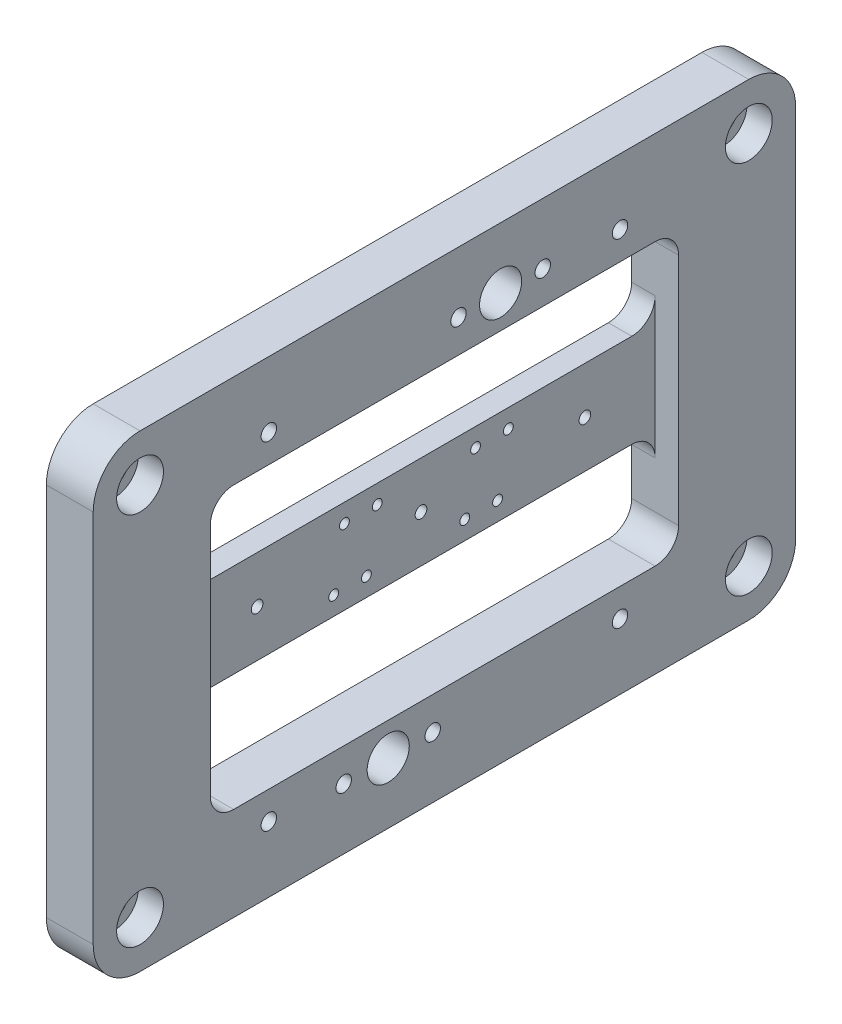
SolidWorks part; units mm, degrees
ref_plane "前视基准面" through (0, 0, 0) normal (0, 0, 1) x (1, 0, 0)
ref_plane "上视基准面" through (0, 0, 0) normal (0, 1, 0) x (1, 0, 0)
ref_plane "右视基准面" through (0, 0, 0) normal (1, 0, 0) x (0, 0, -1)
sketch "草图1" plane through (0, 0, 0) normal (1, 0, 0) x (0, 0, -1)
  line L1 (-65, 50) -> (65, 50)
  line L2 (-75, 40) -> (-75, -40)
  line L3 (-65, -50) -> (65, -50)
  line L4 (75, 40) -> (75, -40)
  line L5 (-75, 50) -> (75, -50) construction
  line L6 (-75, -50) -> (75, 50) construction
  arc A0 (65, 50) -> (75, 40) centre (65, 40) cw
  arc A1 (-75, -40) -> (-65, -50) centre (-65, -40) ccw
  arc A2 (-65, 50) -> (-75, 40) centre (-65, 40) ccw
  arc A3 (65, -50) -> (75, -40) centre (65, -40) ccw
  point P0 (0, 0)
  dimension "D3" = 10
  dimension "D1" = 150
  dimension "D2" = 100
extrude "凸台-拉伸1" add sketch "草图1" along normal blind 10
hole_wizard "Ø12.0mm 暗销孔1" positions "草图2" profile "草图3" hole size "Ø12.0" standard "ISO"
sketch "草图2" plane through (0, 0, 0) normal (-1, 0, 0) x (0, 0, 1)
  line L0 (0, 0) -> (12, 0) construction
  line L2 (0, 0) -> (0, 37) construction
  line L3 (-12, 37) -> (12, 37)
  line L4 (12, 37) -> (12, -37)
  point P0 (-12, 37)
  point P13 (12, -37)
  dimension "D1" = 74
  dimension "D2" = 24
sketch "草图3" plane through (0, 37, -12) normal (0, 1, 0) x (0, 0, 1)
  line L0 (0, 0) -> (0, 2.9)
  line L1 (0, 2.9) -> (6.1, 2.9)
  line L2 (6.1, 2.9) -> (6.1, 0)
  line L5 (6.1, 0) -> (0, 0)
  line L10 (0, 2.9) -> (-6.1, 2.9) construction
  line L11 (0, -6.35) -> (0, 107.95) construction
  dimension "孔直径" = 12.2
  dimension "孔深度" = 2.9
  dimension "导头角度" = 180
hole_wizard "Ø9.0 (9) 直径孔1" positions "草图4" profile "草图5" hole size "Ø9.0" standard "ISO"
sketch "草图4" plane through (10, 0, 0) normal (1, 0, 0) x (0, 0, -1)
  point P29 (-12, -37)
  point P35 (12, 37)
sketch "草图5" plane through (10, -37, 12) normal (0, 1, 0) x (0, 0, -1)
  line L0 (0, 0) -> (0, 17.7039)
  line L1 (0, 17.7039) -> (4.5, 15)
  line L2 (4.5, 15) -> (4.5, 0)
  line L5 (4.5, 0) -> (0, 0)
  line L10 (0, 17.7039) -> (-4.5, 15) construction
  line L11 (0, -6.35) -> (0, 107.95) construction
  dimension "孔直径" = 9
  dimension "孔深度" = 15
  dimension "导头角度" = 118
sketch "草图13" plane through (0, 0, 0) normal (-1, 0, 0) x (0, 0, 1)
  line L0 (0, 0) -> (93.0894, 0) construction
  line L1 (0, 0) -> (0, 31.3557) construction
  circle A2 centre (65, 40) radius 4
  circle A10 centre (65, -40) radius 4
  circle A11 centre (-65, -40) radius 4
  circle A12 centre (-65, 40) radius 4
  dimension "D1" = 8
  dimension "D2" = 65
  dimension "D3" = 40
extrude "切除-拉伸2" cut sketch "草图13" against normal blind 2.6
hole_wizard "M5 六角凹头螺钉的柱形沉头孔1" positions "草图14" profile "草图15" counterbore size "M5" standard "ISO"
sketch "草图14" plane through (10, 0, 0) normal (1, 0, 0) x (0, 0, -1)
  point P0 (-65, 40)
  point P3 (65, 40)
  point P6 (65, -40)
  point P9 (-65, -40)
sketch "草图15" plane through (10, 40, 65) normal (0, 1, 0) x (0, 0, -1)
  line L0 (0, 0) -> (0, 10)
  line L1 (0, 10) -> (2.75, 10)
  line L3 (2.75, 10) -> (2.75, 5.4)
  line L4 (2.75, 5.4) -> (5, 5.4)
  line L5 (5, 5.4) -> (5, 0)
  line L7 (5, 0) -> (0, 0)
  line L11 (0, -6.35) -> (0, 107.95) construction
  dimension "通孔孔直径" = 5.5
  dimension "通孔孔深度" = 10
  dimension "柱形沉头孔直径" = 10
  dimension "柱形沉头孔深度" = 5.4
hole_wizard "M4 螺纹孔1" positions "草图16" profile "草图17" tap size "M4" standard "ISO"
sketch "草图16" plane through (0, 0, 0) normal (-1, 0, 0) x (0, 0, 1)
  line L0 (-12, 37) -> (-3, 37) construction
  line L1 (-12, 37) -> (112.3189, 37) construction
  line L3 (-12, 37) -> (-12, 24.2303) construction
  line L4 (12, -37) -> (21.5, -37) construction
  line L5 (12, -37) -> (12, -21.6104) construction
  point P2 (-3, 37)
  point P15 (21.5, -37)
  point P21 (2.5, -37)
  point P22 (-21, 37)
  dimension "D1" = 9
  dimension "D2" = 9.5
sketch "草图17" plane through (0, 37, -21) normal (0, 1, 0) x (0, 0, 1)
  line L0 (0, 0) -> (0, 10)
  line L1 (0, 10) -> (1.65, 10)
  line L2 (1.65, 10) -> (1.65, 0)
  line L5 (1.65, 0) -> (0, 0)
  line L11 (0, -6.35) -> (0, 107.95) construction
  dimension "通孔螺纹孔钻头直径" = 3.3
  dimension "通孔螺纹孔钻头深度" = 10
sketch "草图18" plane through (0, 0, 0) normal (-1, 0, 0) x (0, 0, 1)
  line L1 (-50, 30) -> (50, 30)
  line L2 (-50, 30) -> (-50, -30)
  line L3 (-50, -30) -> (50, -30)
  line L4 (50, 30) -> (50, -30)
  line L5 (0, -30) -> (0, 30) construction
  line L6 (-50, 0) -> (50, 0) construction
  point P0 (0, 0)
  dimension "D1" = 60
  dimension "D2" = 100
extrude "切除-拉伸3" cut sketch "草图18" against normal through all
fillet "圆角1" radius 5 4 edges at (5, -30, -50) (5, 30, 50) (5, -30, 50) (5, 30, -50)
hole_wizard "M4 螺纹孔2" positions "草图26" profile "草图27" tap size "M4" standard "ISO"
sketch "草图26" plane through (0, 0, 0) normal (-1, 0, 0) x (0, 0, 1)
  line L2 (0, 0) -> (85.8672, 0) construction
  line L4 (0, 0) -> (0, -71.871) construction
  point P0 (37.5, -36)
  point P13 (37.5, 36)
  point P20 (-37.5, 36)
  point P21 (-37.5, -36)
  dimension "D1" = 72
  dimension "D2" = 75
sketch "草图27" plane through (0, -36, 37.5) normal (0, 1, 0) x (0, 0, 1)
  line L0 (0, 0) -> (0, 10)
  line L1 (0, 10) -> (1.65, 10)
  line L2 (1.65, 10) -> (1.65, 0)
  line L5 (1.65, 0) -> (0, 0)
  line L11 (0, -6.35) -> (0, 107.95) construction
  dimension "通孔螺纹孔钻头直径" = 3.3
  dimension "通孔螺纹孔钻头深度" = 10
hole_wizard "M3 螺纹孔3" positions "草图28" profile "草图29" tap size "M3" standard "ISO"
sketch "草图28" [suppressed] plane through (0, 0, 0) normal (-1, 0, 0) x (0, 0, 1)
  line L0 (-65, 27.5) -> (-65, 10.5403) construction
  line L2 (65, -27.5) -> (65, -10.747) construction
  circle A0 centre (-65, 27.5) radius 5 construction
  circle A1 centre (65, -27.5) radius 5 construction
  point P0 (-62, 18.5)
  point P3 (-68, 18.5)
  point P6 (68, -18.5)
  point P9 (62, -18.5)
  dimension "D1" = 9
  dimension "D2" = 6
  dimension "D3" = 3
  dimension "D4" = 9
sketch "草图29" plane through (0, 18.5, -62) normal (0, 1, 0) x (0, 0, 1)
  line L0 (0, 0) -> (0, 8.2511)
  line L1 (0, 8.2511) -> (1.25, 7.5)
  line L2 (1.25, 7.5) -> (1.25, 0)
  line L5 (1.25, 0) -> (0, 0)
  line L10 (0, 8.2511) -> (-1.25, 7.5) construction
  line L11 (0, -6.35) -> (0, 107.95) construction
  dimension "螺纹孔钻头直径" = 2.5
  dimension "螺纹孔钻头深度" = 7.5
  dimension "导头角度" = 118
fillet "圆角3" radius 0.5 2 edges at (2.9, 37, -16.5) (2.9, -37, 7.5)
sketch "草图30" plane through (10, 0, 0) normal (1, 0, 0) x (0, 0, -1)
  line L0 (50, 25) -> (50, -25) construction
  line L1 (-50, 10) -> (50, 10)
  line L2 (-50, 10) -> (-50, -10)
  line L3 (-50, -10) -> (50, -10)
  line L4 (50, 10) -> (50, -10)
  line L5 (-50, 10) -> (50, -10) construction
  line L6 (-50, -10) -> (50, 10) construction
  point P0 (0, 0)
  dimension "D1" = 20
extrude "凸台-拉伸2" add sketch "草图30" against normal up to surface (10 mm away)
fillet "圆角4" radius 5 4 edges at (5, -10, -50) (5, 10, -50) (5, -10, 50) (5, 10, 50)
hole_wizard "Ø2.1 (2.1) 直径孔1" positions "草图31" profile "草图32" hole size "Ø2.1" standard "GB"
sketch "草图31" plane through (10, 0, 0) normal (1, 0, 0) x (0, 0, -1)
  line L0 (0, 0) -> (26.7115, 0) construction
  line L3 (0, 0) -> (0, 10.9287) construction
  point P0 (-9.345, 6.0299)
  point P17 (-11.655, -6.0299)
  point P77 (-16.345, 6.0299)
  point P80 (-18.655, -6.0299)
sketch "草图32" plane through (10, 6.0299, 9.345) normal (0, 1, 0) x (0, 0, -1)
  line L0 (0, 0) -> (0, 10)
  line L1 (0, 10) -> (1.05, 10)
  line L2 (1.05, 10) -> (1.05, 0)
  line L5 (1.05, 0) -> (0, 0)
  line L11 (0, -6.35) -> (0, 107.95) construction
  dimension "通孔孔直径" = 2.1
  dimension "通孔孔深度" = 10
sketch "草图33" plane through (10, 0, 0) normal (1, 0, 0) x (0, 0, -1)
  line L1 (-50, 15) -> (50, 15)
  line L2 (-50, 15) -> (-50, -15)
  line L3 (-50, -15) -> (50, -15)
  line L4 (50, 15) -> (50, -15)
extrude "切除-拉伸4" cut sketch "草图33" against normal blind 5
sketch "草图34" plane through (0, 0, 0) normal (-1, 0, 0) x (0, 0, 1)
  circle A0 centre (9.345, 6.0299) radius 1.6
  circle A1 centre (16.345, 6.0299) radius 1.6
  circle A2 centre (11.655, -6.0299) radius 1.6
  circle A3 centre (18.655, -6.0299) radius 1.6
  dimension "D1" = 3.2
extrude "切除-拉伸5" cut sketch "草图34" against normal blind 2
hole_wizard "M3 螺纹孔4" positions "草图35" profile "草图36" tap size "M3" standard "GB"
sketch "草图35" plane through (0, 0, 0) normal (-1, 0, 0) x (0, 0, 1)
  line L0 (0, 0) -> (0, 17.5636) construction
  line L3 (0, 0) -> (-57.5869, 0) construction
  point P0 (-35, 0)
  point P2 (0, 0)
  point P19 (35, 0)
  dimension "D1" = 70
sketch "草图36" plane through (0, 0, -35) normal (0, 1, 0) x (0, 0, 1)
  line L0 (0, 0) -> (0, 10)
  line L1 (0, 10) -> (1.25, 10)
  line L2 (1.25, 10) -> (1.25, 0)
  line L5 (1.25, 0) -> (0, 0)
  line L11 (0, -6.35) -> (0, 107.95) construction
  dimension "通孔螺纹孔钻头直径" = 2.5
  dimension "通孔螺纹孔钻头深度" = 10
pattern_linear "阵列(线性)1" count 2 spacing 28 along (0, 0, -1) of "切除-拉伸5", "Ø2.1 (2.1) 直径孔1"
